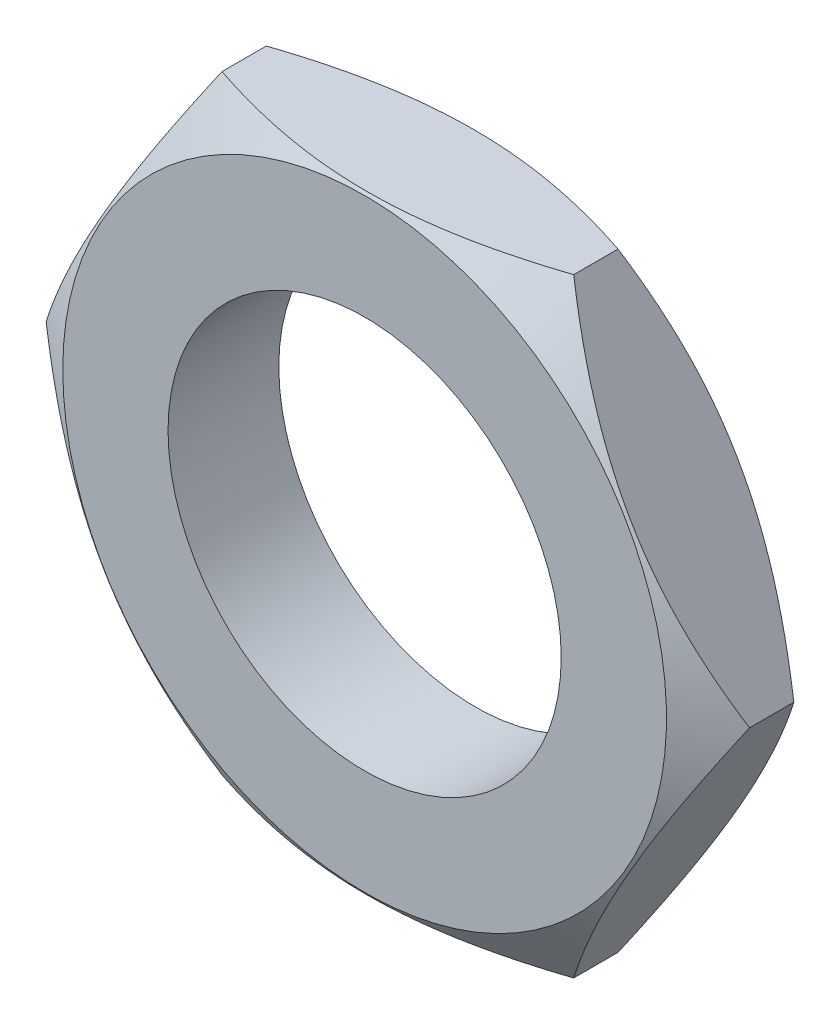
SolidWorks part; units mm, degrees
ref_plane "Plan de face" through (0, 0, 0) normal (0, 0, 1) x (1, 0, 0)
ref_plane "Plan de dessus" through (0, 0, 0) normal (0, 1, 0) x (1, 0, 0)
ref_plane "Plan de droite" through (0, 0, 0) normal (1, 0, 0) x (0, 0, -1)
sketch "Esquisse1" plane through (0, 0, 0) normal (0, 0, 1) x (1, 0, 0)
  line L1 (3.1754, -5.5) -> (6.3509, 0)
  line L2 (6.3509, 0) -> (3.1754, 5.5)
  line L3 (3.1754, 5.5) -> (-3.1754, 5.5)
  line L4 (-3.1754, 5.5) -> (-6.3509, 0)
  line L5 (-6.3509, 0) -> (-3.1754, -5.5)
  line L6 (-3.1754, -5.5) -> (3.1754, -5.5)
  circle A0 centre (0, 0) radius 5.5 construction
  circle A1 centre (0, 0) radius 3.55
  dimension "D1" = 11
  dimension "D2" = 7.1
extrude "Boss.-Extru.1" add sketch "Esquisse1" along normal mid plane 2
sketch "Esquisse2" plane through (0, 0, 0) normal (0, 1, 0) x (1, 0, 0)
  line L0 (-6.3509, -0.4) -> (-5.4509, -1)
  line L1 (-6.3509, -1) -> (-6.3509, 1) construction
  line L3 (-6.3509, -0.4) -> (-6.3509, -1)
  line L4 (-6.3509, -1) -> (-5.4509, -1)
  dimension "D1" = 0.6
  dimension "D2" = 0.9
ref_axis "Axe1" through (0, 0, -0.1) along (0, 0, 1)
revolve "Enlèvement de matière-Révolution1" cut sketch "Esquisse2" angle 360 about axis through (0, 0, -0.1) along (0, 0, 1)
mirror "Symétrie2" about plane through (0, 0, 0) normal (0, 0, 1) of "Enlèvement de matière-Révolution1"
